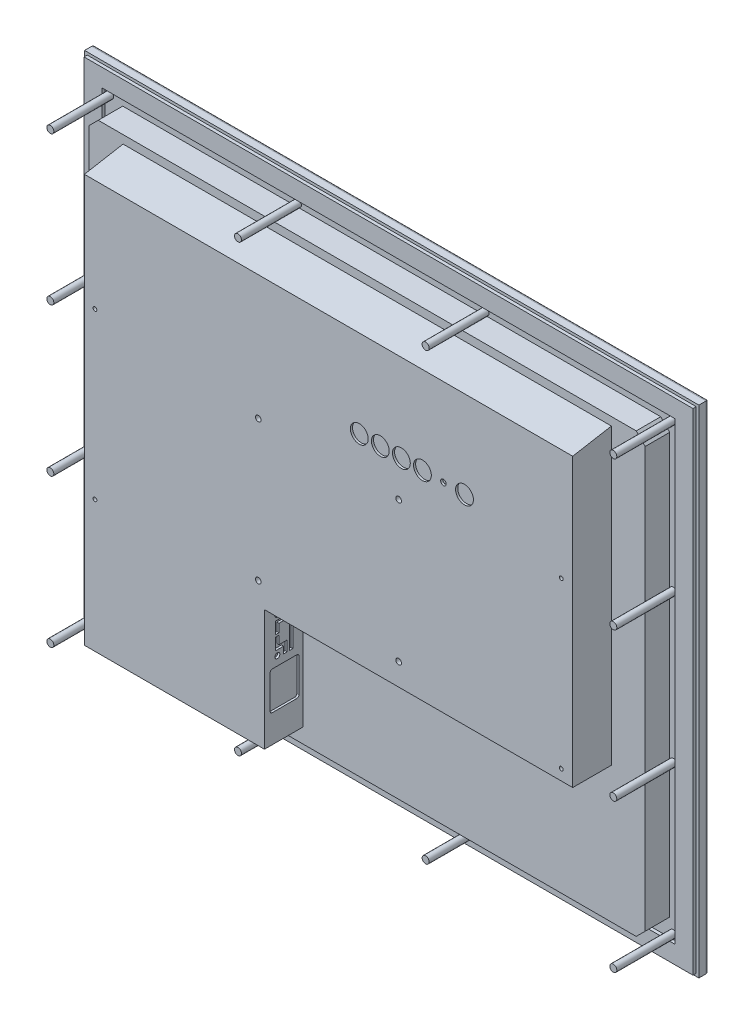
SolidWorks part; units mm, degrees
ref_plane "Front Plane" through (0, 0, 0) normal (0, 0, 1) x (1, 0, 0)
ref_plane "Top Plane" through (0, 0, 0) normal (0, 1, 0) x (1, 0, 0)
ref_plane "Right Plane" through (0, 0, 0) normal (1, 0, 0) x (0, 0, -1)
sketch "Sketch1" plane through (0, 0, 0) normal (0, 0, 1) x (1, 0, 0)
  line L0 (-218.8845, 176.784) -> (218.8845, 176.784)
  line L1 (218.8845, 176.784) -> (218.8845, -176.784)
  line L2 (218.8845, -176.784) -> (-218.8845, -176.784)
  line L3 (-218.8845, -176.784) -> (-218.8845, 176.784)
  point P2 (0, -176.784)
  point P3 (218.8845, 0)
  dimension "D1" = 437.769
  dimension "D2" = 353.568
extrude "Bezel" add sketch "Sketch1" against normal blind 7.112
fillet "Bezel Radius" radius 2 4 edges at (0, -176.784, -7.112) (0, 176.784, -7.112) (-218.8845, 0, -7.112) (218.8845, 0, -7.112)
sketch "Sketch2" plane through (0, 0, -7.112) normal (0, 0, -1) x (-1, 0, 0)
  line L0 (-170.18, 136.398) -> (170.18, 136.398)
  line L1 (170.18, 136.398) -> (170.18, -136.398)
  line L2 (170.18, -136.398) -> (-170.18, -136.398)
  line L3 (-170.18, -136.398) -> (-170.18, 136.398)
  line L4 (216.8845, 174.784) -> (-216.8845, 174.784) construction
  line L5 (-216.8845, 174.784) -> (-216.8845, -174.784) construction
  point P0 (0, 136.398)
  point P6 (0, 174.784)
  point P8 (-170.18, 0)
  point P11 (-216.8845, 0)
  dimension "D1" = 340.36
  dimension "D2" = 272.796
extrude "Window" cut sketch "Sketch2" against normal blind 2.35
sketch "Sketch3" plane through (0, 0, 0) normal (0, 0, 1) x (1, 0, 0)
  line L4 (-216.9795, 174.879) -> (216.9795, 174.879)
  line L5 (216.9795, 174.879) -> (216.9795, -174.879)
  line L6 (216.9795, -174.879) -> (-216.9795, -174.879)
  line L7 (-216.9795, -174.879) -> (-216.9795, 174.879)
  line L8 (218.8845, 176.784) -> (-218.8845, 176.784) construction
  line L9 (-218.8845, 176.784) -> (-218.8845, -176.784) construction
  line L10 (-218.8845, -176.784) -> (218.8845, -176.784) construction
  line L11 (218.8845, -176.784) -> (218.8845, 176.784) construction
  line L12 (-204.2795, -162.179) -> (-204.2795, 162.179)
  line L13 (-204.2795, 162.179) -> (204.2795, 162.179)
  line L14 (204.2795, 162.179) -> (204.2795, -162.179)
  line L15 (204.2795, -162.179) -> (-204.2795, -162.179)
  dimension "D1" = 1.905
  dimension "D2" = 1.905
  dimension "D3" = 1.905
  dimension "D4" = 1.905
  dimension "D5" = 12.7
extrude "Gasket" add sketch "Sketch3" along normal blind 2.3
sketch "Sketch5" plane through (0, 0, 0) normal (0, 0, 1) x (1, 0, 0)
  line L0 (-218.8845, 176.784) -> (-218.8845, -176.784) construction
  line L1 (218.8845, 176.784) -> (-218.8845, 176.784) construction
  line L2 (-218.8845, -176.784) -> (218.8845, -176.784) construction
  line L4 (218.8845, -176.784) -> (218.8845, 176.784) construction
  circle A0 centre (-200.5965, 158.496) radius 2.5
  circle A6 centre (-200.5965, -158.496) radius 2.5
  circle A8 centre (-66.8655, 158.496) radius 2.5
  circle A9 centre (-66.8655, -158.496) radius 2.5
  circle A10 centre (66.8655, 158.496) radius 2.5
  circle A11 centre (66.8655, -158.496) radius 2.5
  circle A12 centre (200.5965, 158.496) radius 2.5
  circle A13 centre (200.5965, -158.496) radius 2.5
  circle A14 centre (-200.5965, 52.832) radius 2.5
  circle A15 centre (200.5965, 52.832) radius 2.5
  circle A16 centre (-200.5965, -52.832) radius 2.5
  circle A17 centre (200.5965, -52.832) radius 2.5
  dimension "D1" = 5
  dimension "D2" = 18.288
  dimension "D3" = 18.288
  dimension "D4" = 18.288
  dimension "D5" = 18.288
  dimension "D6" = 4
  dimension "D7" = 3
  dimension "D8" = 105.664
extrude "Panel Frame Studs" add sketch "Sketch5" along normal blind 42.7
sketch "Sketch6" plane through (0, 0, 0) normal (0, 0, 1) x (1, 0, 0)
  line L0 (-198.0965, 149.5841) -> (-191.6846, 155.996)
  line L1 (-191.6846, 155.996) -> (191.6846, 155.996)
  line L2 (191.6846, 155.996) -> (198.0965, 149.5841)
  line L3 (198.0965, 149.5841) -> (198.0965, -149.5841)
  line L4 (198.0965, -149.5841) -> (191.6846, -155.996)
  line L5 (191.6846, -155.996) -> (-191.6846, -155.996)
  line L6 (-191.6846, -155.996) -> (-198.0965, -149.5841)
  line L7 (-198.0965, -149.5841) -> (-198.0965, 149.5841)
  circle A0 centre (-200.5965, 158.496) radius 2.5 construction
  circle A1 centre (200.5965, 158.496) radius 2.5 construction
  circle A2 centre (-200.5965, -158.496) radius 2.5 construction
  dimension "D1" = 9.0678
  dimension "D2" = 45
extrude "Body" add sketch "Sketch6" along normal blind 17.4498 separate body
sketch "Sketch7" plane through (0, 0, 17.4498) normal (0, 0, 1) x (1, 0, 0)
  line L0 (-173.99, 150.1394) -> (173.99, 150.1394)
  line L1 (173.99, 150.1394) -> (173.99, -59.2074)
  line L2 (173.99, -59.2074) -> (-45.6692, -59.2074)
  line L3 (-45.6692, -59.2074) -> (-45.6692, -145.3896)
  line L4 (-45.6692, -145.3896) -> (-173.99, -145.3896)
  line L5 (-173.99, -145.3896) -> (-173.99, 150.1394)
  line L6 (-191.6846, -155.996) -> (191.6846, -155.996) construction
  line L7 (-218.8845, -176.784) -> (218.8845, -176.784) construction
  line L9 (-198.0965, 149.5841) -> (-198.0965, -149.5841) construction
  point P3 (0, 150.1394)
  dimension "D1" = 347.98
  dimension "D2" = 209.3468
  dimension "D3" = 219.6592
  dimension "D4" = 86.1822
  dimension "D5" = 31.3944
extrude "Rear Cover" add sketch "Sketch7" along normal blind 27.559
draft "Rear Cover Slope" type of draft neutral plane draft angle 10 faces to draft 1 parameters "D1"=10
hole_wizard "Ø4.0mm VESA Holes" positions "Sketch8" profile "Sketch9" hole size "Ø4.0" standard "ANSI Metric"
sketch "Sketch8" plane through (0, 0, 45.0088) normal (0, 0, 1) x (1, 0, 0)
  line L0 (-218.8845, -176.784) -> (218.8845, -176.784) construction
  line L1 (-218.8845, 176.784) -> (-218.8845, -176.784) construction
  point P0 (-50.0253, 56.5152)
  point P2 (49.9747, 56.5152)
  point P4 (49.9747, -43.4848)
  point P6 (-50.0253, -43.4848)
  dimension "D1" = 100
  dimension "D2" = 100
  dimension "D3" = 133.2992
  dimension "D4" = 168.8592
sketch "Sketch9" plane through (-50.0253, 56.5152, 45.0088) normal (1, 0, 0) x (0, -1, 0)
  line L0 (0, 0) -> (0, 17.2037)
  line L1 (0, 17.2037) -> (2, 16.002)
  line L2 (2, 16.002) -> (2, 0)
  line L5 (2, 0) -> (0, 0)
  line L10 (0, 17.2037) -> (-2, 16.002) construction
  line L11 (0, -6.35) -> (0, 107.95) construction
  dimension "Hole Dia." = 4
  dimension "Hole Depth" = 16.002
  dimension "Drill Angle" = 118
sketch "Sketch10" plane through (0, -59.2074, 0) normal (0, 1, 0) x (1, 0, 0)
  line L0 (173.99, -45.0088) -> (173.99, -17.4498) construction
  line L1 (-45.6692, -45.0088) -> (173.99, -45.0088) construction
  line L53 (51.4743, -30.7409) -> (51.4743, -25.6609)
  line L54 (27.1983, -33.9134) -> (48.4263, -33.9134)
  line L55 (27.1983, -22.4885) -> (48.4263, -22.4885)
  line L56 (24.1503, -25.6609) -> (24.1503, -30.7409)
  line L57 (85.6427, -27.1722) -> (85.6427, -32.2522)
  line L58 (68.3707, -35.4247) -> (82.5947, -35.4247)
  line L59 (65.3227, -27.1722) -> (65.3227, -32.2522)
  line L60 (68.3707, -23.9998) -> (82.4671, -23.9972)
  line L61 (109.9921, -26.8166) -> (109.9921, -31.8966)
  line L62 (127.2641, -23.6442) -> (113.0401, -23.6442)
  line L63 (130.3121, -31.8966) -> (130.3121, -26.8166)
  line L64 (113.0401, -35.0691) -> (127.1365, -35.0716)
  line L65 (161.9307, -23.2479) -> (145.9287, -23.2479)
  line L66 (161.9307, -30.9314) -> (161.9307, -35.4399)
  line L67 (145.9287, -35.4399) -> (161.9307, -35.4399)
  line L68 (145.9287, -30.9314) -> (145.9287, -35.4399)
  line L69 (141.4837, -30.9314) -> (145.9287, -30.9314)
  line L70 (141.4837, -27.7564) -> (145.9287, -27.7564)
  line L71 (145.9287, -23.2479) -> (145.9287, -27.7564)
  line L72 (161.9307, -27.7564) -> (161.9307, -23.2479)
  line L73 (161.9307, -30.9314) -> (166.3757, -30.9314)
  line L74 (161.9307, -27.7564) -> (166.3757, -27.7564)
  circle A42 centre (54.0683, -28.2009) radius 1.5875
  arc A43 (51.4743, -30.7409) -> (48.4263, -33.9134) centre (48.2993, -30.7409) cw
  arc A44 (48.4263, -22.4885) -> (51.4743, -25.6609) centre (48.2993, -25.6609) cw
  arc A45 (24.1503, -25.6609) -> (27.1983, -22.4885) centre (27.3253, -25.6609) cw
  arc A46 (27.1983, -33.9134) -> (24.1503, -30.7409) centre (27.3253, -30.7409) cw
  circle A47 centre (21.5563, -28.2009) radius 1.5875
  arc A48 (68.3707, -35.4247) -> (65.3227, -32.2522) centre (68.4977, -32.2522) cw
  circle A49 centre (87.9827, -29.7249) radius 1.5875
  arc A50 (85.6427, -32.2522) -> (82.5947, -35.4247) centre (82.4677, -32.2522) cw
  circle A51 centre (62.9827, -29.7249) radius 1.5875
  arc A52 (65.3227, -27.1722) -> (68.3707, -23.9998) centre (68.4977, -27.1722) cw
  arc A53 (82.4671, -23.9972) -> (85.6427, -27.1722) centre (82.4677, -27.1722) cw
  circle A54 centre (107.6521, -29.3439) radius 1.5875
  arc A55 (109.9921, -26.8166) -> (113.0401, -23.6442) centre (113.1671, -26.8166) cw
  arc A56 (127.2641, -23.6442) -> (130.3121, -26.8166) centre (127.1371, -26.8166) cw
  arc A57 (130.3121, -31.8966) -> (127.1365, -35.0716) centre (127.1371, -31.8966) cw
  arc A58 (113.0401, -35.0691) -> (109.9921, -31.8966) centre (113.1671, -31.8966) cw
  circle A59 centre (132.6521, -29.3439) radius 1.5875
  arc A60 (141.4837, -30.9314) -> (141.4837, -27.7564) centre (141.4837, -29.3439) cw
  arc A61 (166.3757, -27.7564) -> (166.3757, -30.9314) centre (166.3757, -29.3439) cw
  dimension "D1" = 7.6143
  dimension "D2" = 15.6649
extrude "Video / Touch Interface" cut sketch "Sketch10" along normal blind 1.524 from surface at 0
sketch "Sketch11" plane through (-45.6692, 0, 0) normal (-1, 0, 0) x (0, 0, 1)
  line L0 (45.0088, -145.3896) -> (17.4498, -145.3896) construction
  line L1 (45.0088, -145.3896) -> (45.0088, -59.2074) construction
  line L49 (31.3182, -93.3873) -> (31.3182, -88.574)
  line L50 (31.3182, -93.3873) -> (28.7782, -93.3873)
  line L51 (28.7782, -93.3873) -> (28.7782, -86.034)
  line L52 (27.2542, -65.4473) -> (27.2542, -93.3873)
  line L53 (27.2542, -93.3873) -> (24.7142, -93.3873)
  line L54 (24.7142, -93.3873) -> (24.7142, -65.4473)
  line L55 (24.7142, -65.4473) -> (27.2542, -65.4473)
  line L56 (28.7782, -65.4473) -> (31.3182, -65.4473)
  line L57 (31.3182, -65.4473) -> (31.3182, -70.2606)
  line L58 (28.7782, -65.4473) -> (28.7782, -72.8006)
  line L59 (28.7782, -72.8006) -> (34.671, -72.8006)
  line L60 (31.3182, -70.2606) -> (37.211, -70.2606)
  line L61 (37.211, -70.2606) -> (37.211, -78.6553)
  line L62 (37.211, -78.6553) -> (34.671, -78.6553)
  line L63 (34.671, -72.8006) -> (34.671, -78.6553)
  line L64 (34.671, -80.1793) -> (37.211, -80.1793)
  line L65 (37.211, -88.574) -> (37.211, -80.1793)
  line L66 (34.671, -80.1793) -> (34.671, -86.034)
  line L67 (28.7782, -86.034) -> (34.671, -86.034)
  line L68 (31.3182, -88.574) -> (37.211, -88.574)
  line L69 (20.4599, -100.1195) -> (20.4599, -124.059)
  line L70 (21.9839, -98.5955) -> (39.4353, -98.5955)
  line L71 (40.9578, -124.059) -> (40.9578, -100.1195)
  line L72 (39.4338, -125.583) -> (21.9824, -125.583)
  circle A12 centre (35.814, -92.2062) radius 1.7907
  circle A13 centre (35.814, -66.6284) radius 1.7907
  arc A14 (21.9824, -125.583) -> (20.4599, -124.059) centre (21.9839, -124.059) cw
  arc A15 (20.4599, -100.1195) -> (21.9839, -98.5955) centre (21.9839, -100.1195) cw
  arc A16 (39.4353, -98.5955) -> (40.9578, -100.1195) centre (39.4338, -100.1195) cw
  arc A17 (40.9578, -124.059) -> (39.4338, -125.583) centre (39.4338, -124.059) cw
  dimension "D1" = 19.8066
  dimension "D2" = 4.051
extrude "Power AC and DC" cut sketch "Sketch11" along normal blind 1.524 from surface at 0
sketch "Sketch12" plane through (0, 0, 45.0088) normal (0, 0, 1) x (1, 0, 0)
  line L0 (-218.8845, -176.784) -> (218.8845, -176.784) construction
  line L1 (-218.8845, 176.784) -> (-218.8845, -176.784) construction
  circle A6 centre (21.8883, 83.0427) radius 6.35
  circle A7 centre (36.8883, 83.0427) radius 6.35
  circle A8 centre (51.8883, 83.0427) radius 6.35
  circle A9 centre (66.8883, 83.0427) radius 6.35
  circle A10 centre (81.8883, 83.0427) radius 1.9812
  circle A11 centre (96.8883, 83.0427) radius 6.35
  dimension "D1" = 259.8267
  dimension "D2" = 240.7728
extrude "Controls Buttons" cut sketch "Sketch12" against normal blind 1.524 from surface at 0
hole_wizard "6-32 Accessory Bracket Holes" positions "Sketch13" profile "Sketch14" hole size "#6-32" standard "ANSI Inch"
sketch "Sketch13" plane through (0, 0, 45.0088) normal (0, 0, 1) x (1, 0, 0)
  line L0 (-218.8845, 176.784) -> (-218.8845, -176.784) construction
  line L1 (-218.8845, -176.784) -> (218.8845, -176.784) construction
  point P0 (-166.4589, -51.5874)
  point P2 (-166.4589, 65.9384)
  point P4 (165.8747, 65.9384)
  point P6 (165.8747, -51.5874)
  dimension "D1" = 117.5258
  dimension "D2" = 332.3336
  dimension "D3" = 52.4256
  dimension "D4" = 125.1966
sketch "Sketch14" plane through (-166.4589, -51.5874, 45.0088) normal (1, 0, 0) x (0, -1, 0)
  line L0 (0, 0) -> (0, 16.8147)
  line L1 (0, 16.8147) -> (1.3525, 16.002)
  line L2 (1.3525, 16.002) -> (1.3525, 0)
  line L5 (1.3525, 0) -> (0, 0)
  line L10 (0, 16.8147) -> (-1.3526, 16.002) construction
  line L11 (0, -6.35) -> (0, 107.95) construction
  dimension "Hole Dia." = 2.7051
  dimension "Hole Depth" = 16.002
  dimension "Drill Angle" = 118
